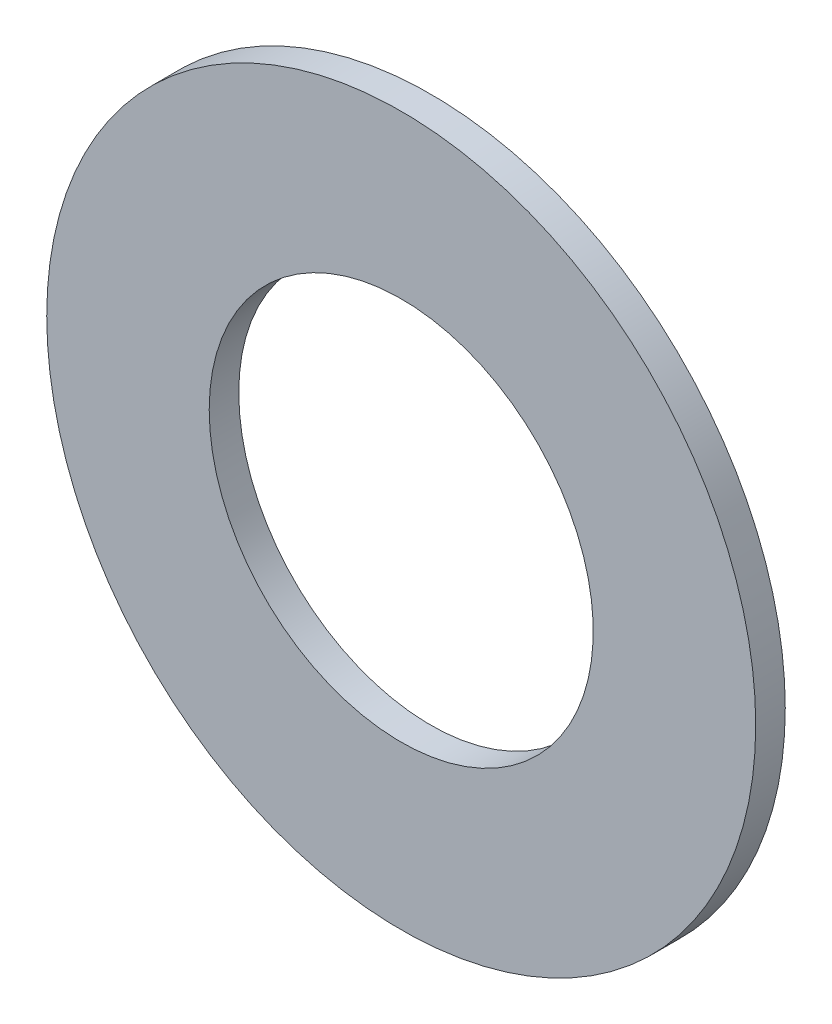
SolidWorks part; units mm, degrees
ref_plane "Face" through (0, 0, 0) normal (0, 0, 1) x (1, 0, 0)
ref_plane "Dessus" through (0, 0, 0) normal (0, 1, 0) x (1, 0, 0)
ref_plane "Droite" through (0, 0, 0) normal (1, 0, 0) x (0, 0, -1)
sketch "Esquisse1" plane through (0, 0, 0) normal (0, 0, 1) x (1, 0, 0)
  circle A0 centre (0, 0) radius 3.25
  circle A1 centre (0, 0) radius 6
  dimension "D1" = 6.5
  dimension "D2" = 12
extrude "Extrusion1" add sketch "Esquisse1" along normal blind 0.5
